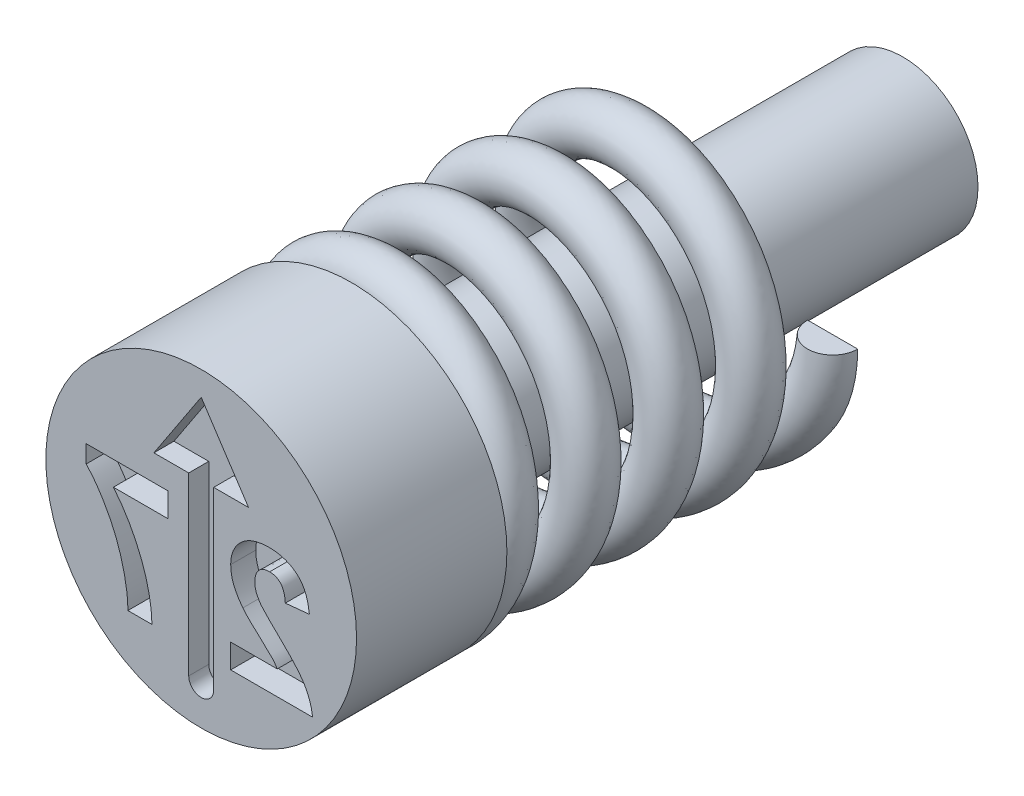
SolidWorks part; units mm, degrees
other "<DCSPR12>-<Cut-Extrude1>"
ref_plane "Front Plane" through (0, 0, 0) normal (0, 0, 1) x (1, 0, 0)
ref_plane "Top Plane" through (0, 0, 0) normal (0, 1, 0) x (1, 0, 0)
ref_plane "Right Plane" through (0, 0, 0) normal (1, 0, 0) x (0, 0, -1)
sketch "Sketch2" plane through (0, 0, 0) normal (0, 1, 0) x (1, 0, 0)
  line L5 (3.1, 0) -> (3.1, 3)
  line L6 (3.1, 3) -> (1.5, 3)
  line L7 (1.5, 3) -> (1.5, 14)
  line L8 (1.5, 14) -> (0, 14)
  line L9 (0, 0) -> (3.1, 0)
  line L10 (0, 0) -> (0, 50000) construction
  line L11 (0, 14) -> (0, 0)
  dimension "D1" = 3
  dimension "D2" = 14
  dimension "D3" = 6.2
  dimension "D4" = 3
revolve "Revolve1" add sketch "Sketch2" angle 360 about L10
sketch "Sketch3" plane through (0, 0, 0) normal (0, 0, 1) x (1, 0, 0)
  line L0 (-0.249, 1.185) -> (-0.9438, 1.185)
  line L1 (0, -0.9219) -> (0, 0.9385) construction
  line L2 (-0.249, -2.3221) -> (-0.249, 1.185)
  line L3 (-0.9438, 1.185) -> (0, 2.6176)
  line L12 (0.9438, 1.185) -> (0, 2.6176)
  line L16 (0.249, -2.3221) -> (0.249, 1.185)
  line L17 (0.249, 1.185) -> (0.9438, 1.185)
  arc A2 (-0.249, -2.3221) -> (0.249, -2.3221) centre (0, -2.3221) ccw
extrude "Cut-Extrude1" cut sketch "Sketch3" against normal blind 0.4
sketch "Sketch4" plane through (0, 0, 0) normal (0, 0, 1) x (1, 0, 0)
  text T0 "2 7" font "Arial" height 2.5
  dimension "D1" = 1.8
extrude "Cut-Extrude2" cut sketch "Sketch4" against normal blind 0.5
inserted part "DCSPR12"
move or copy body "Body-Move/Copy2" placed by mates yes
